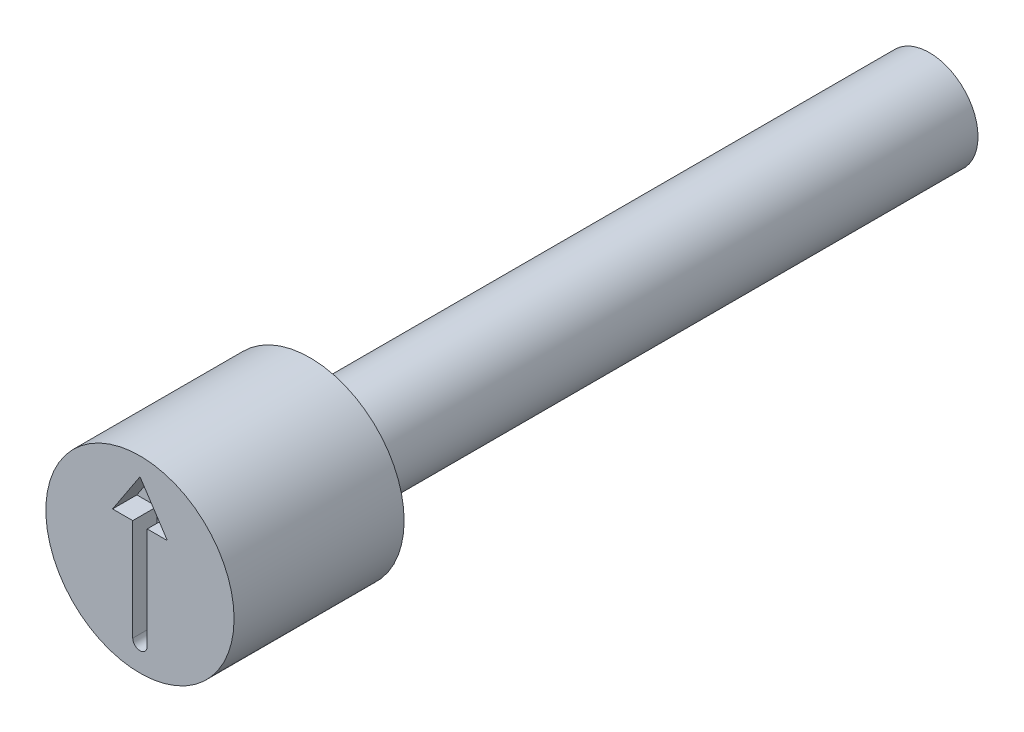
SolidWorks part; units mm, degrees
ref_plane "Front Plane" through (0, 0, 0) normal (0, 0, 1) x (1, 0, 0)
ref_plane "Top Plane" through (0, 0, 0) normal (0, 1, 0) x (1, 0, 0)
ref_plane "Right Plane" through (0, 0, 0) normal (1, 0, 0) x (0, 0, -1)
sketch "Sketch2" plane through (0, 0, 0) normal (1, 0, 0) x (0, 0, -1)
  line L0 (0.4039, 0) -> (50000.4039, 0) construction
  line L6 (0, 1.55) -> (0, 0)
  line L7 (2.8, 1.55) -> (0, 1.55)
  line L8 (2.8, 0.8) -> (2.8, 1.55)
  line L9 (13, 0.8) -> (2.8, 0.8)
  line L10 (13, 0) -> (13, 0.8)
  line L11 (0, 0) -> (13, 0)
  dimension "D1" = 3.1
  dimension "D2" = 1.6
  dimension "D3" = 13
  dimension "D4" = 2.8
revolve "Revolve1" add sketch "Sketch2" angle 360 about L0
sketch "Sketch3" plane through (0, 0, 0) normal (0, 0, 1) x (1, 0, 0)
  line L0 (0, 0) -> (0, 62500) construction
  line L1 (0.119, 0.5665) -> (0.119, -1.1101)
  line L2 (0.4512, 0.5665) -> (0.119, 0.5665)
  line L3 (0, 1.2513) -> (0.4512, 0.5665)
  line L15 (0, 1.2513) -> (-0.4512, 0.5665)
  line L16 (-0.4512, 0.5665) -> (-0.119, 0.5665)
  line L17 (-0.119, 0.5665) -> (-0.119, -1.1101)
  arc A2 (-0.119, -1.1101) -> (0.119, -1.1101) centre (0, -1.1101) ccw
extrude "Cut-Extrude4" cut sketch "Sketch3" against normal blind 0.4
